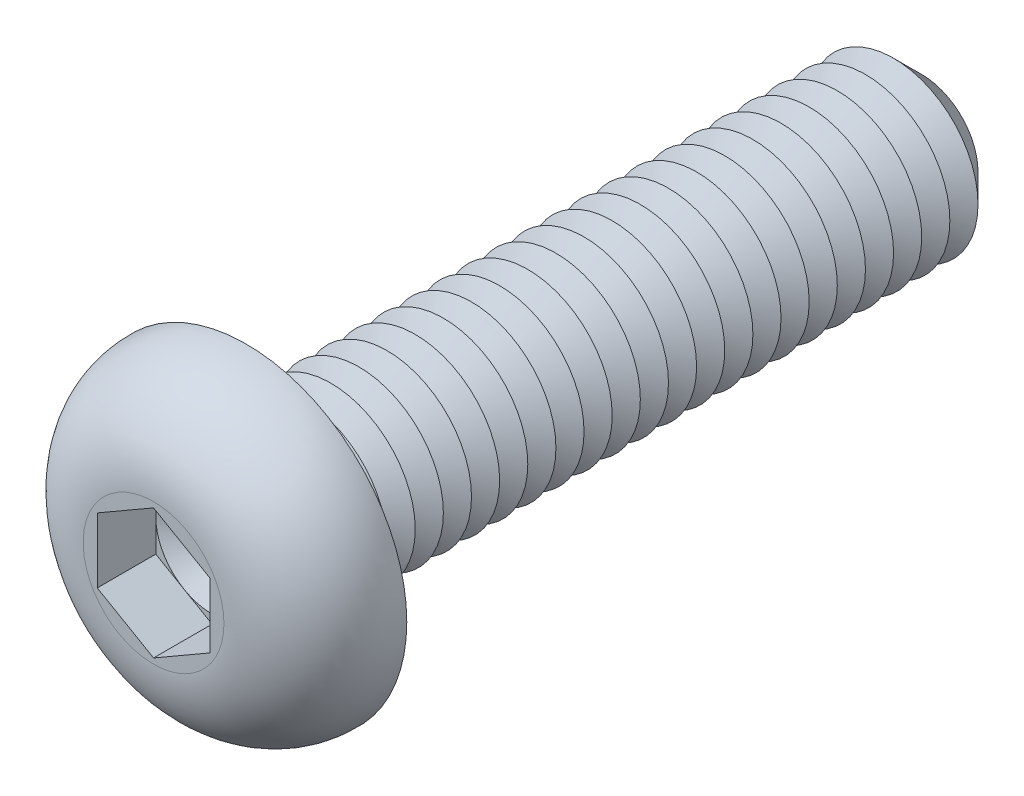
SolidWorks part; units mm, degrees
ref_plane "Front Plane" through (0, 0, 0) normal (0, 0, 1) x (1, 0, 0)
ref_plane "Top Plane" through (0, 0, 0) normal (0, 1, 0) x (1, 0, 0)
ref_plane "Right Plane" through (0, 0, 0) normal (1, 0, 0) x (0, 0, -1)
sketch "Sketch1" plane through (0, 0, 0) normal (1, 0, 0) x (0, 0, -1)
  line L0 (-47.9342, 0) -> (60.3146, 0) construction
sketch "Sketch2" plane through (0, 0, 0) normal (1, 0, 0) x (0, 0, -1)
  line L0 (0, 0) -> (-1.65, 0)
  line L1 (-47.9342, 0) -> (60.3146, 0) construction
  line L2 (-1.65, 0) -> (-1.65, 1.2508)
  line L3 (0, 2.85) -> (0, 0)
  arc A0 (-1.65, 1.2508) -> (0, 2.85) centre (-0.05, 1.2508) cw
  dimension "D1" = 1.6
  dimension "D2" = 1.65
  dimension "D3" = 2.85
revolve "Revolve1" add sketch "Sketch2" angle 360 about L0
sketch "Sketch3" plane through (0, 0, 1.65) normal (0, 0, 1) x (1, 0, 0)
  line L1 (0, 1.1547) -> (-1, 0.5774)
  line L2 (-1, 0.5774) -> (-1, -0.5774)
  line L3 (-1, -0.5774) -> (0, -1.1547)
  line L4 (0, -1.1547) -> (1, -0.5774)
  line L5 (1, -0.5774) -> (1, 0.5774)
  line L6 (1, 0.5774) -> (0, 1.1547)
  circle A0 centre (0, 0) radius 1 construction
  dimension "D1" = 2
extrude "Cut-Extrude1" cut sketch "Sketch3" against normal blind 1.04
sketch "Sketch4" plane through (0, 0, 0) normal (0, 0, -1) x (-1, 0, 0)
  circle A0 centre (0, 0) radius 1.5
  dimension "D1" = 3
extrude "Boss-Extrude1" add sketch "Sketch4" along normal blind 12
chamfer "Chamfer1" distance 0.5 angle 45 1 edges at (-1.5, 0, -12)
sketch "Sketch5" plane through (0, 0, 0) normal (1, 0, 0) x (0, 0, -1)
  line L0 (0.5, 1.5) -> (1, 1.5)
  line L1 (11.5, 1.5) -> (0, 1.5) construction
  line L2 (1, 1.5) -> (0.75, 1.067)
  line L3 (0.75, 1.067) -> (0.5, 1.5)
  line L4 (0, -2.85) -> (0, 2.85) construction
  line L5 (11.5, 1.5) -> (0, 1.5) construction
  dimension "D1" = 0.5
  dimension "D2" = 0.5
revolve "Cut-Revolve1" cut sketch "Sketch5" angle 360 about L0
pattern_linear "LPattern1" count 22 spacing 0.5 along (0, 0, -1) of "Cut-Revolve1"
fillet "Fillet2" radius 0.2 1 edges at (1.5, 0, 0)
sketch "Sketch6" plane through (0, 0, 0.61) normal (0, 0, 1) x (1, 0, 0)
  line L0 (0, -1.1547) -> (1, -0.5774) construction
  circle A0 centre (0, 0) radius 1
extrude "Cut-Extrude2" cut sketch "Sketch6" against normal through all draft 60
